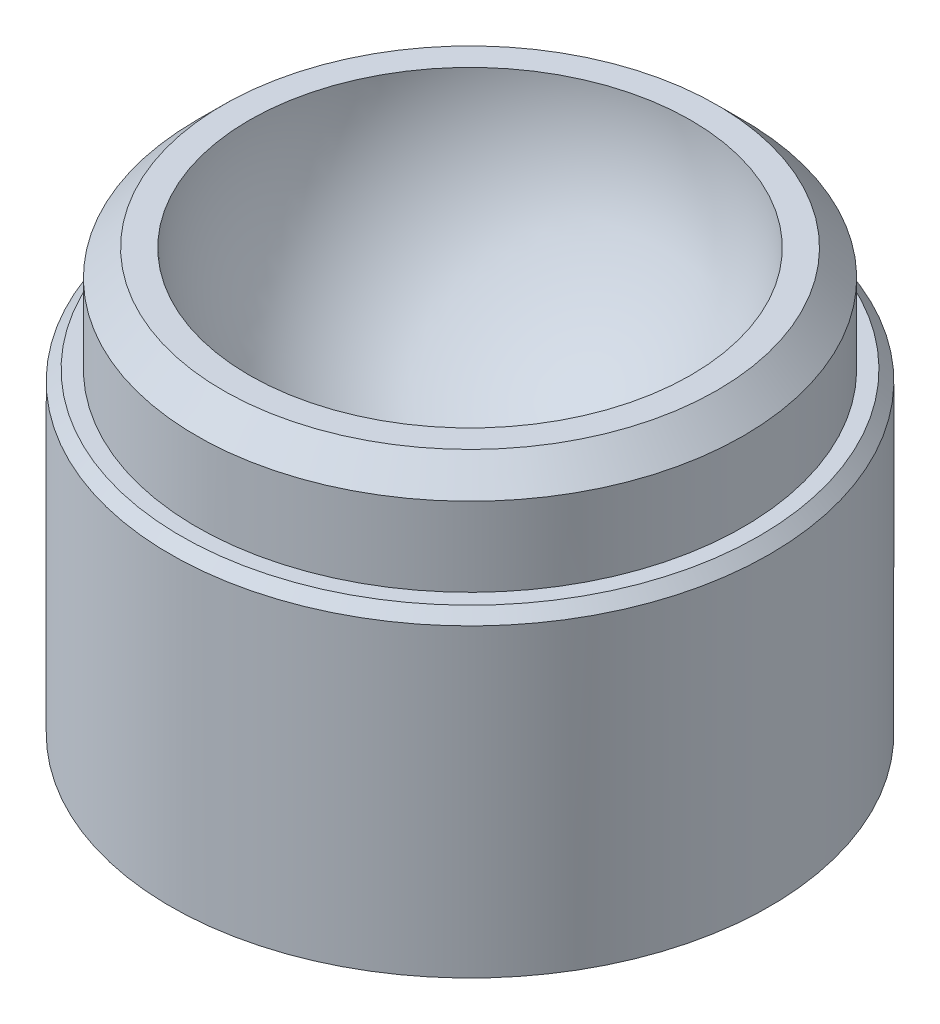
SolidWorks part; units mm, degrees
ref_plane "Plan de face" through (0, 0, 0) normal (0, 0, 1) x (1, 0, 0)
ref_plane "Plan de dessus" through (0, 0, 0) normal (0, 1, 0) x (1, 0, 0)
ref_plane "Plan de droite" through (0, 0, 0) normal (1, 0, 0) x (0, 0, -1)
sketch "Esquisse1" plane through (0, 0, 0) normal (0, 0, 1) x (1, 0, 0)
  line L0 (0, -6.2) -> (0, -10)
  line L1 (4.8168, -2) -> (0, -2) construction
  line L3 (5.2, -2) -> (5.2, -4)
  line L5 (0, 0) -> (0, -8.0108) construction
  line L6 (4.2, -2) -> (5.2, -2)
  line L8 (5.2, -4) -> (5.7, -4)
  line L9 (5.7, -4) -> (5.7, -10)
  line L10 (5.7, -10) -> (0, -10)
  arc A1 (0, -6.2) -> (4.2, -2) centre (0, -2) ccw
  dimension "D1" = 2
  dimension "D3" = 6
  dimension "D5" = 1
  dimension "D4" = 4.2
  dimension "D2" = 0.5
revolve "Révolution1" add sketch "Esquisse1" angle 360 about L0
chamfer "Chanfrein1" distance 0.5 angle 45 1 edges at (-5.2, -2, 0)
chamfer "Chanfrein2" distance 0.2 angle 45 1 edges at (-5.7, -4, 0)
